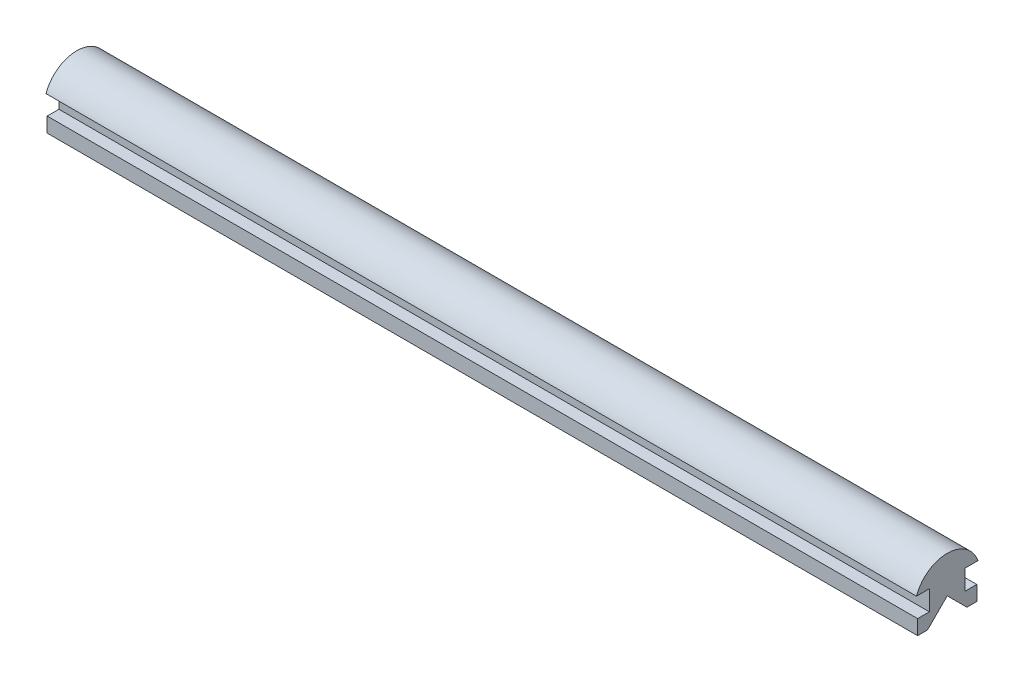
SolidWorks part; units mm, degrees
ref_plane "Front Plane" through (0, 0, 0) normal (0, 0, 1) x (1, 0, 0)
ref_plane "Top Plane" through (0, 0, 0) normal (0, 1, 0) x (1, 0, 0)
ref_plane "Right Plane" through (0, 0, 0) normal (1, 0, 0) x (0, 0, -1)
sketch3d "3DSketch1"
  line L0 (0, 0, 0) -> (200, 0, 0)
  dimension "D1" = 200
other "Liukuohjaimet 1.6034 LIUKUOHJAIN PYÖREÄ(1)"
ref_plane "Plane1" through (0, 0, 0) normal (1, 0, 0) x (0, 0, -1)
sketch "Sketch1" plane through (0, 0, 0) normal (1, 0, 0) x (0, 0, -1)
  line L0 (-6.6689, -2.7722) -> (-6.6689, -6.1722)
  line L1 (-6.6689, -6.1722) -> (-4.3973, -6.1722)
  line L2 (-4.3973, -6.1722) -> (0.1311, -1.6438)
  line L3 (0.1311, -1.6438) -> (4.6595, -6.1722)
  line L4 (4.6595, -6.1722) -> (6.9311, -6.1722)
  line L5 (6.9311, -6.1722) -> (6.9311, -2.7722)
  line L6 (6.9311, -2.7722) -> (4.2311, -2.7722)
  line L7 (4.2311, -2.7722) -> (4.2311, 1.8278)
  line L8 (4.2311, 1.8278) -> (7.2022, 1.8278)
  line L9 (-6.94, 1.8278) -> (-3.9689, 1.8278)
  line L10 (-3.9689, 1.8278) -> (-3.9689, -2.7722)
  line L11 (-3.9689, -2.7722) -> (-6.6689, -2.7722)
  arc A0 (7.2022, 1.8278) -> (-6.94, 1.8278) centre (0.1311, -0.6722) ccw
  point P14 (0, 0)
